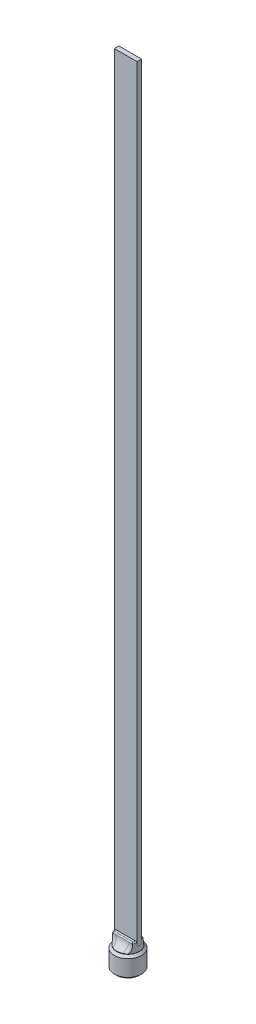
SolidWorks part; units mm, degrees
ref_plane "Front Plane" through (0, 0, 0) normal (0, 0, 1) x (1, 0, 0)
ref_plane "Top Plane" through (0, 0, 0) normal (0, 1, 0) x (1, 0, 0)
ref_plane "Right Plane" through (0, 0, 0) normal (1, 0, 0) x (0, 0, -1)
imported_body "Imported1"
sketch "Sketch1" plane through (0, 12.2428, 0) normal (0, 1, 0) x (1, 0, 0)
  line L0 (-5.4051, 1.0795) -> (5.4051, 1.0795)
  line L1 (5.4051, -1.0795) -> (-5.4051, -1.0795)
  line L2 (5.3014, 1.0795) -> (-5.3014, 1.0795) construction
  line L3 (-5.3014, -1.0795) -> (5.3014, -1.0795) construction
  arc A0 (5.4051, -1.0795) -> (5.4051, 1.0795) centre (0, 0) ccw
  arc A1 (-5.4051, 1.0795) -> (-5.4051, -1.0795) centre (0, 0) ccw
  dimension "D1" = 11.0236
extrude "Boss-Extrude1" add sketch "Sketch1" along normal offset from surface (368.7572 mm away) 381
